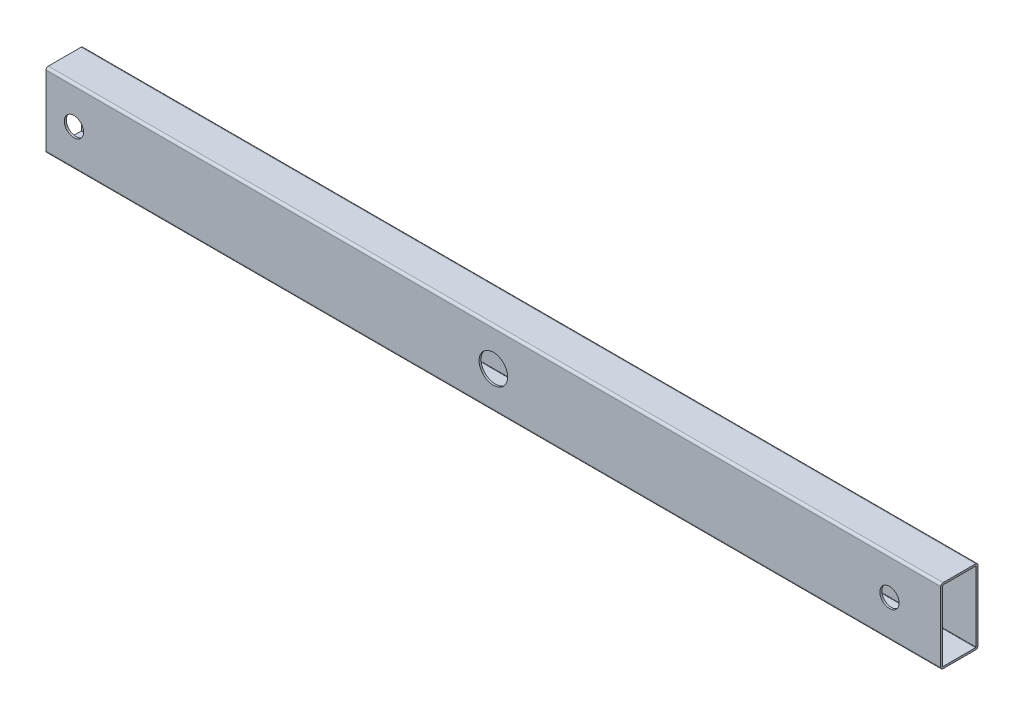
SolidWorks part; units mm, degrees
ref_plane "Front Plane" through (0, 0, 0) normal (0, 0, 1) x (1, 0, 0)
ref_plane "Top Plane" through (0, 0, 0) normal (0, 1, 0) x (1, 0, 0)
ref_plane "Right Plane" through (0, 0, 0) normal (1, 0, 0) x (0, 0, -1)
sketch "Sketch1" plane through (0, 0, 0) normal (1, 0, 0) x (0, 0, -1)
  line L0 (-5.373, 3.898) -> (16.852, 3.898)
  line L1 (-5.373, 5.2442) -> (16.852, 5.2442)
  line L2 (-6.9605, 3.6567) -> (-6.9605, -43.9683)
  line L3 (-5.373, -45.5558) -> (16.852, -45.5558)
  line L4 (18.4395, 3.6567) -> (18.4395, -43.9683)
  line L5 (17.0933, 3.6567) -> (17.0933, -43.9683)
  line L6 (-5.373, -44.2096) -> (16.852, -44.2096)
  line L7 (-5.6143, 3.6567) -> (-5.6143, -43.9683)
  arc A0 (16.852, 5.2442) -> (18.4395, 3.6567) centre (16.852, 3.6567) cw
  arc A1 (-6.9605, 3.6567) -> (-5.373, 5.2442) centre (-5.373, 3.6567) cw
  arc A2 (-5.373, -45.5558) -> (-6.9605, -43.9683) centre (-5.373, -43.9683) cw
  arc A3 (18.4395, -43.9683) -> (16.852, -45.5558) centre (16.852, -43.9683) cw
  arc A4 (16.852, 3.898) -> (17.0933, 3.6567) centre (16.852, 3.6567) cw
  arc A5 (17.0933, -43.9683) -> (16.852, -44.2096) centre (16.852, -43.9683) cw
  arc A6 (-5.373, -44.2096) -> (-5.6143, -43.9683) centre (-5.373, -43.9683) cw
  arc A7 (-5.6143, 3.6567) -> (-5.373, 3.898) centre (-5.373, 3.6567) cw
  point P6 (18.4395, 5.2442)
  point P9 (-6.9605, 5.2442)
  point P14 (18.4395, -45.5558)
  dimension "D3" = 1.5875
  dimension "D1" = 25.4
  dimension "D2" = 50.8
  dimension "D4" = 1.3462
extrude "Extrude1" add sketch "Sketch1" along normal blind 609.6
sketch "Sketch4" plane through (0, 0, -17.0933) normal (0, 0, 1) x (1, 0, 0)
  line L0 (609.6, -43.9683) -> (609.6, 3.6567) construction
  line L1 (609.6, 5.2442) -> (0, 5.2442) construction
  circle A0 centre (304.8, -20.1558) radius 9.7234
  dimension "D3" = 19.4469
  dimension "D1" = 304.8
  dimension "D2" = 25.4
extrude "Cut-Extrude1" cut sketch "Sketch4" against normal through all and the other way through all
sketch "Sketch6" plane through (0, 0, -17.0933) normal (0, 0, 1) x (1, 0, 0)
  line L0 (609.6, 5.2442) -> (0, 5.2442) construction
  line L1 (0, -43.9683) -> (0, 3.6567) construction
  circle A0 centre (19.05, -20.1558) radius 6.5484
  dimension "D1" = 13.0969
  dimension "D2" = 25.4
  dimension "D3" = 19.05
extrude "Cut-Extrude2" cut sketch "Sketch6" against normal through all and the other way through all
sketch "Sketch7" plane through (0, 0, -18.4395) normal (0, 0, -1) x (-1, 0, 0)
  line L1 (-609.6, 3.6567) -> (-609.6, -43.9683) construction
  line L2 (-609.6, -45.5558) -> (0, -45.5558) construction
  circle A1 centre (-574.675, -20.1558) radius 6.5484
  point P6 (-609.6, -20.1558)
  dimension "D1" = 25.4
  dimension "D3" = 13.0969
  dimension "D4" = 34.925
extrude "Cut-Extrude3" cut sketch "Sketch7" against normal through all
